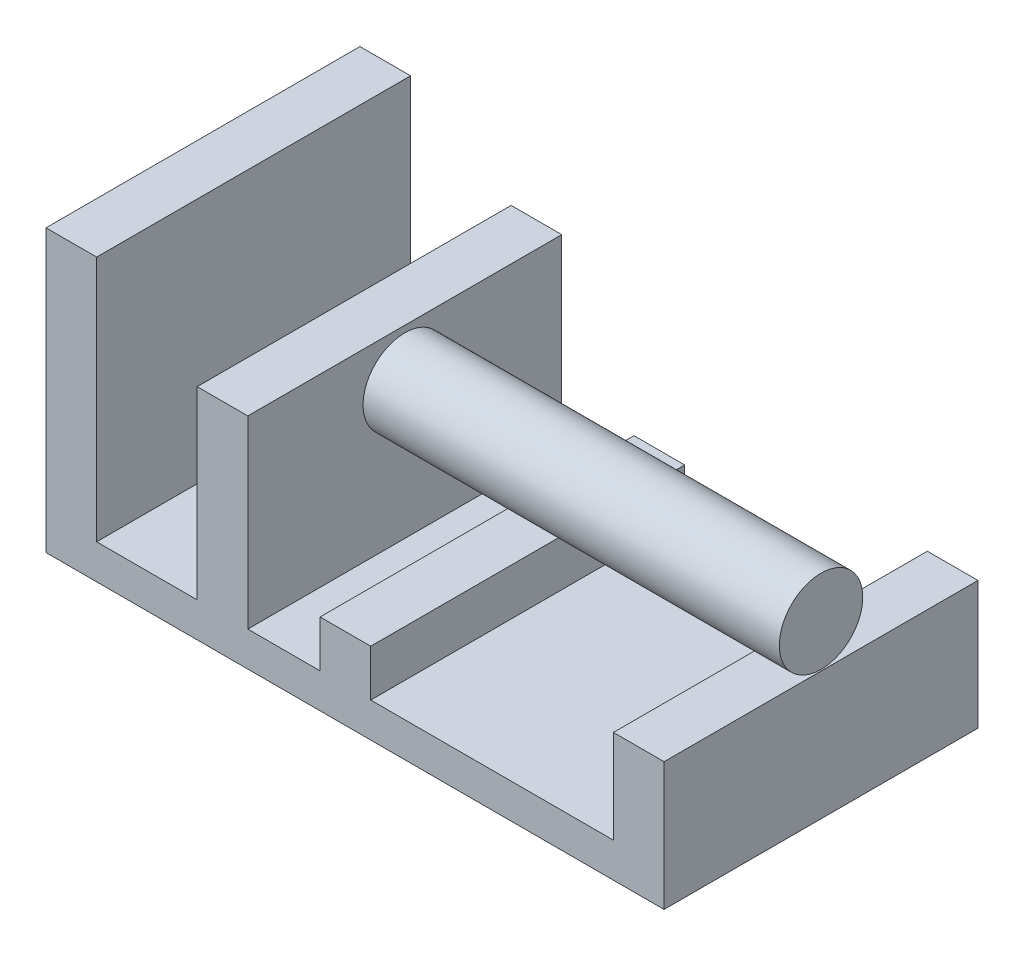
SolidWorks part; units mm, degrees
ref_plane "Front Plane" through (0, 0, 0) normal (0, 0, 1) x (1, 0, 0)
ref_plane "Top Plane" through (0, 0, 0) normal (0, 1, 0) x (1, 0, 0)
ref_plane "Right Plane" through (0, 0, 0) normal (1, 0, 0) x (0, 0, -1)
sketch "Sketch1" plane through (0, 0, 0) normal (0, 0, 1) x (1, 0, 0)
  line L0 (0, 67.4845) -> (0, 0)
  line L1 (0, 0) -> (148.2903, 0)
  line L2 (148.2903, 0) -> (148.2903, 30.7016)
  line L3 (148.2903, 30.7016) -> (136.1376, 30.7016)
  line L4 (136.1376, 30.7016) -> (136.1376, 8.315)
  line L5 (136.1376, 8.315) -> (77.9104, 8.315)
  line L6 (77.9104, 8.315) -> (77.9104, 19.5083)
  line L7 (77.9104, 19.5083) -> (65.7577, 19.5083)
  line L8 (65.7577, 19.5083) -> (65.7577, 8.315)
  line L9 (65.7577, 8.315) -> (48.4217, 8.315)
  line L10 (48.4217, 8.315) -> (48.4217, 52.6144)
  line L11 (48.4217, 52.6144) -> (36.269, 52.6144)
  line L12 (36.269, 52.6144) -> (36.269, 8.315)
  line L13 (36.269, 8.315) -> (12.1527, 8.315)
  line L14 (12.1527, 8.315) -> (12.1527, 67.4845)
  line L15 (12.1527, 67.4845) -> (0, 67.4845)
extrude "Extrude1" add sketch "Sketch1" along normal mid plane 75.319
sketch "Sketch2" plane through (148.2903, 0, 0) normal (1, 0, 0) x (0, 0, -1)
  circle A0 centre (0, 41.0398) radius 10.0121
extrude "Boss-Extrude1" add sketch "Sketch2" along direction (-1, 0, 0) on the side against the normal up to vertex (99.8687 mm away)
